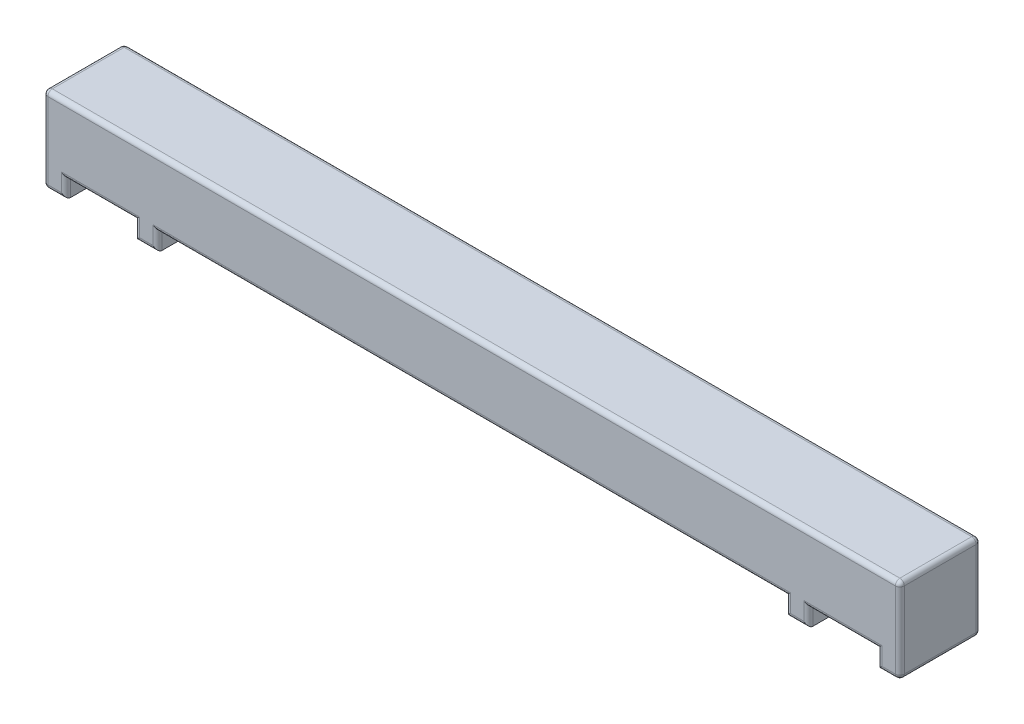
SolidWorks part; units mm, degrees
ref_plane "Front Plane" through (0, 0, 0) normal (0, 0, 1) x (1, 0, 0)
ref_plane "Top Plane" through (0, 0, 0) normal (0, 1, 0) x (1, 0, 0)
ref_plane "Right Plane" through (0, 0, 0) normal (1, 0, 0) x (0, 0, -1)
sketch "Sketch1" plane through (0, 0, 0) normal (0, 1, 0) x (1, 0, 0)
  line L1 (-95.4, 9) -> (95.4, 9)
  line L2 (-95.4, 9) -> (-95.4, -9)
  line L3 (-95.4, -9) -> (95.4, -9)
  line L4 (95.4, 9) -> (95.4, -9)
  line L5 (-95.4, 9) -> (95.4, -9) construction
  line L6 (-95.4, -9) -> (95.4, 9) construction
  point P0 (0, 0)
  dimension "D1" = 18
  dimension "D2" = 190.8
extrude "Boss-Extrude1" add sketch "Sketch1" along normal blind 15
sketch "Sketch3" plane through (0, 15, 0) normal (0, 1, 0) x (1, 0, 0)
  line L0 (-95.4, -9) -> (95.4, -9) construction
  line L1 (-0.5, 9) -> (0.5, 9)
  line L2 (-0.5, 9) -> (-0.5, -9)
  line L3 (-0.5, -9) -> (0.5, -9)
  line L4 (0.5, 9) -> (0.5, -9)
  line L5 (-0.5, 9) -> (0.5, -9) construction
  line L6 (-0.5, -9) -> (0.5, 9) construction
  point P0 (0, 0)
  dimension "D1" = 1
sketch "Sketch4" plane through (0, 0, 0) normal (0, -1, 0) x (1, 0, 0)
  line L0 (95.4, -9) -> (-95.4, -9) construction
  line L1 (-95.4, 9) -> (-90.4, 9)
  line L2 (-95.4, 9) -> (-95.4, -9)
  line L3 (-95.4, -9) -> (-90.4, -9)
  line L4 (-90.4, 9) -> (-90.4, -9)
  line L5 (-95.4, 9) -> (95.4, 9) construction
  line L7 (-75, 9) -> (-70, 9)
  line L8 (-75, 9) -> (-75, -9)
  line L9 (-75, -9) -> (-70, -9)
  line L10 (-70, 9) -> (-70, -9)
  line L11 (95.4, 9) -> (90.4, 9)
  line L12 (95.4, 9) -> (95.4, -9)
  line L13 (95.4, -9) -> (90.4, -9)
  line L14 (90.4, 9) -> (90.4, -9)
  line L15 (75, 9) -> (70, 9)
  line L16 (75, 9) -> (75, -9)
  line L17 (75, -9) -> (70, -9)
  line L18 (70, 9) -> (70, -9)
  dimension "D1" = 5
  dimension "D2" = 5
  dimension "D3" = 5
  dimension "D4" = 5
  dimension "D5" = 150
  dimension "D6" = 15.4
extrude "Boss-Extrude2" add sketch "Sketch4" along normal blind 4
fillet "Fillet1" [suppressed] radius 1
fillet "Fillet2" radius 1 36 edges at (92.9, -4, 9) (90.4, -2, 9) (82.7, 0, 9) (75, -2, 9) (72.5, -4, 9) (70, -2, 9) (0, 0, 9) (-70, -2, 9) (-72.5, -4, 9) (-75, -2, 9) (-82.7, 0, 9) (-90.4, -2, 9) (-92.9, -4, 9) (-92.9, -4, -9) (-90.4, -2, -9) (-82.7, 0, -9) (-75, -2, -9) (-72.5, -4, -9) (-70, -2, -9) (0, 0, -9) (70, -2, -9) (72.5, -4, -9) (75, -2, -9) (82.7, 0, -9) (90.4, -2, -9) (92.9, -4, -9) (-95.4, 5.5, 9) (-95.4, -4, 0) (-95.4, 5.5, -9) (95.4, 5.5, -9) (95.4, -4, 0) (95.4, 5.5, 9) (0, 15, 9) (-95.4, 15, 0) (0, 15, -9) (95.4, 15, 0)
